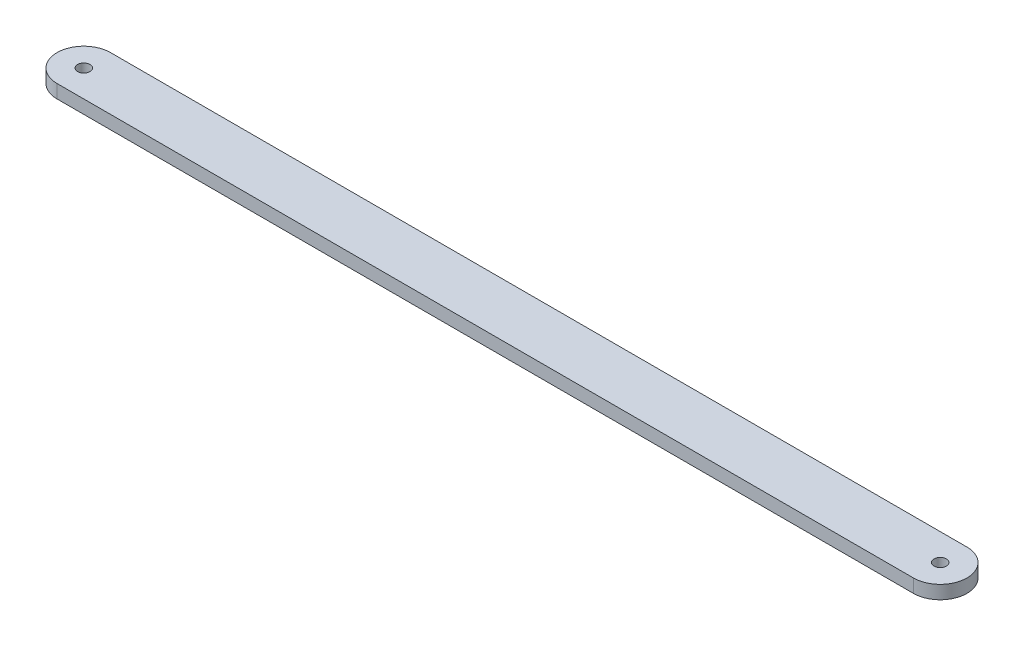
SolidWorks part; units mm, degrees
ref_plane "Front Plane" through (0, 0, 0) normal (0, 0, 1) x (1, 0, 0)
ref_plane "Top Plane" through (0, 0, 0) normal (0, 1, 0) x (1, 0, 0)
ref_plane "Right Plane" through (0, 0, 0) normal (1, 0, 0) x (0, 0, -1)
sketch "Sketch1" plane through (0, 0, 0) normal (0, 1, 0) x (1, 0, 0)
  line L0 (0, 0) -> (203.2, 0) construction
  line L1 (0, 6.35) -> (203.2, 6.35)
  line L2 (0, -6.35) -> (203.2, -6.35)
  arc A0 (0, 6.35) -> (0, -6.35) centre (0, 0) ccw
  arc A1 (203.2, -6.35) -> (203.2, 6.35) centre (203.2, 0) ccw
  point P3 (101.6, 0)
  dimension "D1" = 203.2
  dimension "D2" = 12.7
extrude "Boss-Extrude1" add sketch "Sketch1" along normal blind 3.175
hole_wizard "#4 Clearance Hole1" positions "Sketch3" profile "Sketch2" hole size "#4" standard "ANSI Inch"
sketch "Sketch3" plane through (0, 3.175, 0) normal (0, 1, 0) x (1, 0, 0)
  point P0 (0, 0)
  point P3 (203.2, 0)
sketch "Sketch2" plane through (0, 3.175, 0) normal (1, 0, 0) x (0, 0, 1)
  line L0 (0, 0) -> (0, 3.302)
  line L1 (0, 3.302) -> (1.4732, 3.302)
  line L2 (1.4732, 3.302) -> (1.4732, 0)
  line L5 (1.4732, 0) -> (0, 0)
  line L10 (0, 3.302) -> (-1.4732, 3.302) construction
  line L11 (0, -6.35) -> (0, 107.95) construction
  dimension "Hole Dia." = 2.9464
  dimension "Hole Depth" = 3.302
  dimension "Drill Angle" = 180
